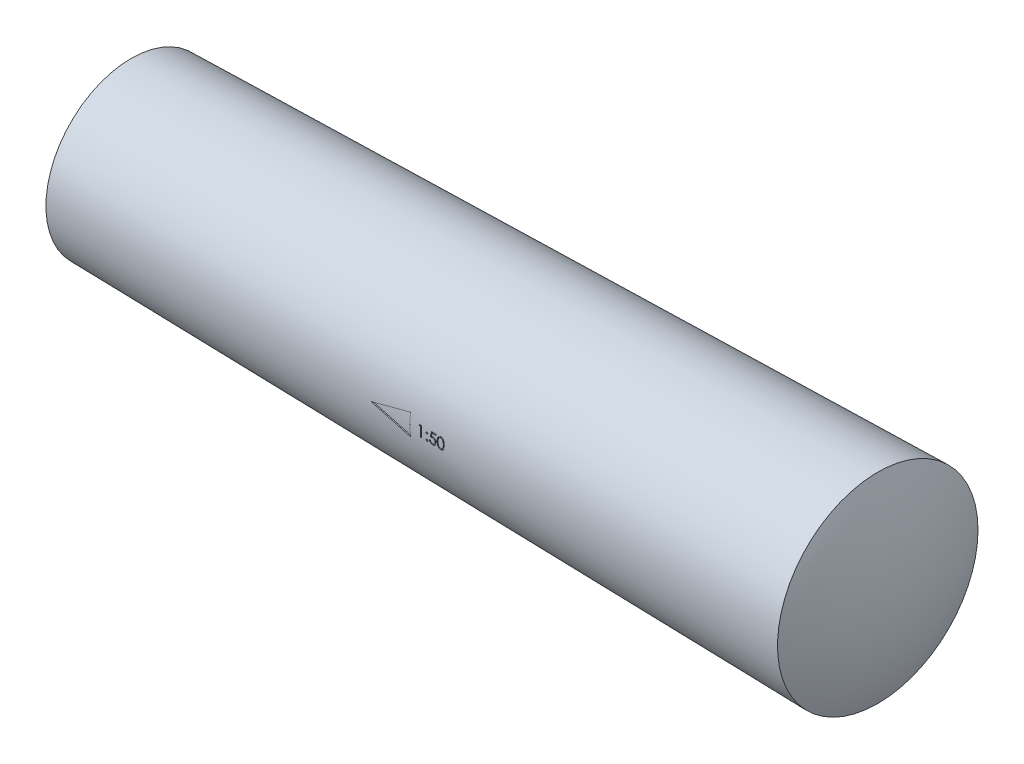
SolidWorks part; units mm, degrees
ref_plane "Front Plane" through (0, 0, 0) normal (0, 0, 1) x (1, 0, 0)
ref_plane "Top Plane" through (0, 0, 0) normal (0, 1, 0) x (1, 0, 0)
ref_plane "Right Plane" through (0, 0, 0) normal (1, 0, 0) x (0, 0, -1)
sketch "Sketch1" plane through (0, 0, 0) normal (1, 0, 0) x (0, 0, -1)
  circle A0 centre (0, 0) radius 8
  dimension "D1" = 16
extrude "Extrude1" add sketch "Sketch1" along normal mid plane 70
draft "Draft1" type of draft neutral plane draft angle 1.146 faces to draft 1 parameters "D1"=1.146
sketch "Sketch2" plane through (0, 0, 0) normal (0, 0, 1) x (1, 0, 0)
  line L0 (-35, 0) -> (-35, 8)
  line L1 (-35, 8) -> (-35, -8) construction
  line L2 (-35, 0) -> (-37, 0)
  line L3 (-37, 0) -> (-37, -8.7) construction
  line L4 (35, 0) -> (35, 9.4)
  line L5 (35, -9.4) -> (35, 9.4) construction
  line L6 (35, 0) -> (37, 0)
  line L7 (37, 0) -> (37, -8.7) construction
  line L8 (-35, -8) -> (35, -9.4) construction
  arc A0 (-37, 0) -> (-35, 8) centre (-20, 0) cw
  arc A1 (37, 0) -> (35, 9.4) centre (13.9098, 0) ccw
  point P14 (0, -8.7)
revolve "Revolve1" add sketch "Sketch2" angle 360 about L2
sketch "Sketch5" plane through (0, 0, 0) normal (0, 0, 1) x (1, 0, 0)
  line L0 (0, 8.7) -> (0, -8.7) construction
  line L1 (35, 9.4) -> (-35, 8) construction
  line L2 (-35, -8) -> (35, -9.4) construction
ref_plane "Plane2" through (0, 0, 0) normal (-0.02, 0, 0.9998) x (0.9998, 0, 0.02)
sketch "Sketch6" plane through (0, 0, 0) normal (-0.02, 0, 0.9998) x (0.9998, 0, 0.02)
  line L0 (0, 0) -> (0, 1)
  line L1 (0, 8.7) -> (0, -8.7) construction
  line L2 (0, 1) -> (-3.7321, 0)
  line L3 (-3.7321, 0) -> (0, -1)
  line L4 (0, -1) -> (0, 0)
  line L5 (0, -0.5) -> (4, -0.5) construction
  text T0 "1:50" font "Century Gothic" height 1
  dimension "D1" = 2
  dimension "D2" = 30
  dimension "D3" = 4
wrap "Wrap2" sketch "Sketch6" wrap type deboss source sketch "Sketch6" thickness 0.1 parameters "D1"=0.1
equation "\"D2@Sketch2\" = \"D1@Sketch2\""
